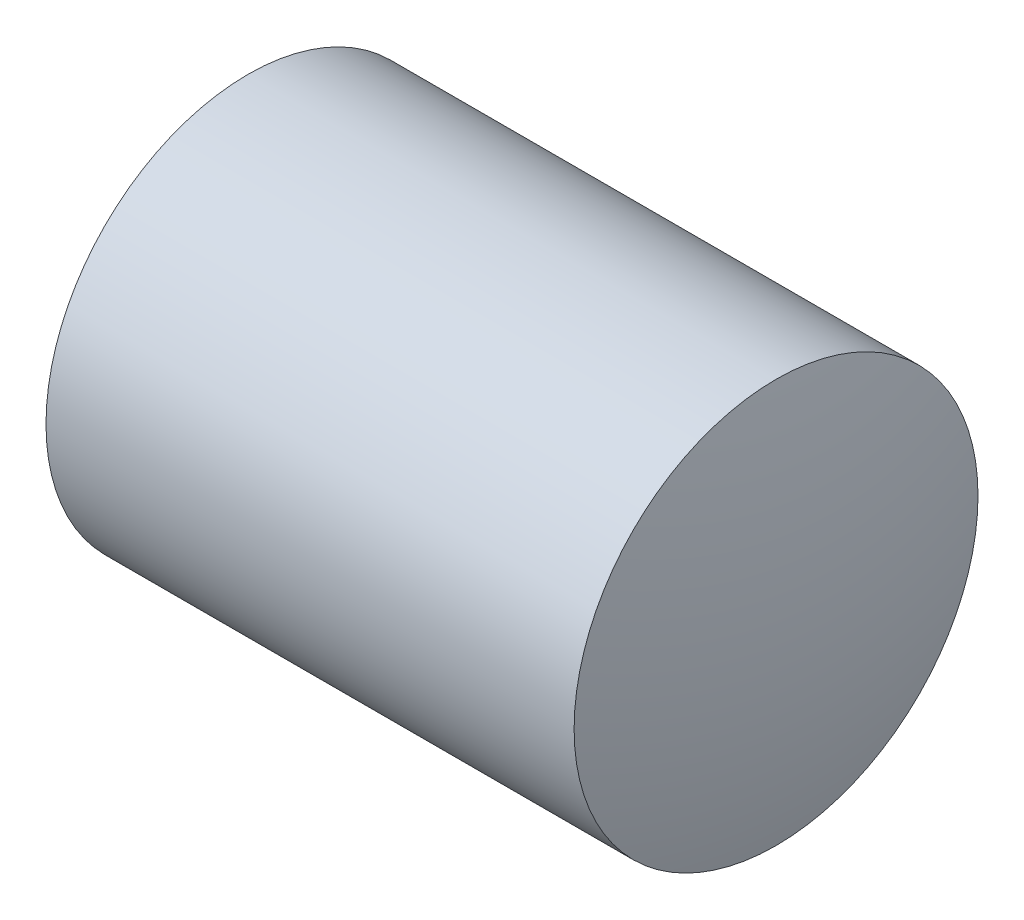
SolidWorks part; units mm, degrees
ref_plane "Vorne" through (0, 0, 0) normal (0, 0, 1) x (1, 0, 0)
ref_plane "Oben" through (0, 0, 0) normal (0, 1, 0) x (1, 0, 0)
ref_plane "Rechts" through (0, 0, 0) normal (1, 0, 0) x (0, 0, -1)
sketch "Skizze1" plane through (0, 0, 0) normal (0, 0, 1) x (1, 0, 0)
  line L0 (0, 0) -> (79.1682, 0) construction
  line L1 (15.383, 3) -> (24.272, 3) construction
  line L2 (17.5, 0) -> (24.655, 0)
  line L3 (16.4265, 3) -> (24.272, 3)
  arc A0 (24.655, 0) -> (24.272, 3) centre (12.715, 0) ccw construction
  arc A2 (24.655, 0) -> (24.272, 3) centre (12.715, 0) ccw
  arc A3 (17.5, 0) -> (16.4265, 3) centre (12.7713, 0) ccw construction
  arc A4 (17.5, 0) -> (16.4265, 3) centre (12.7713, 0) ccw
revolve "Rotation1" add sketch "Skizze1" angle 360 about L2
